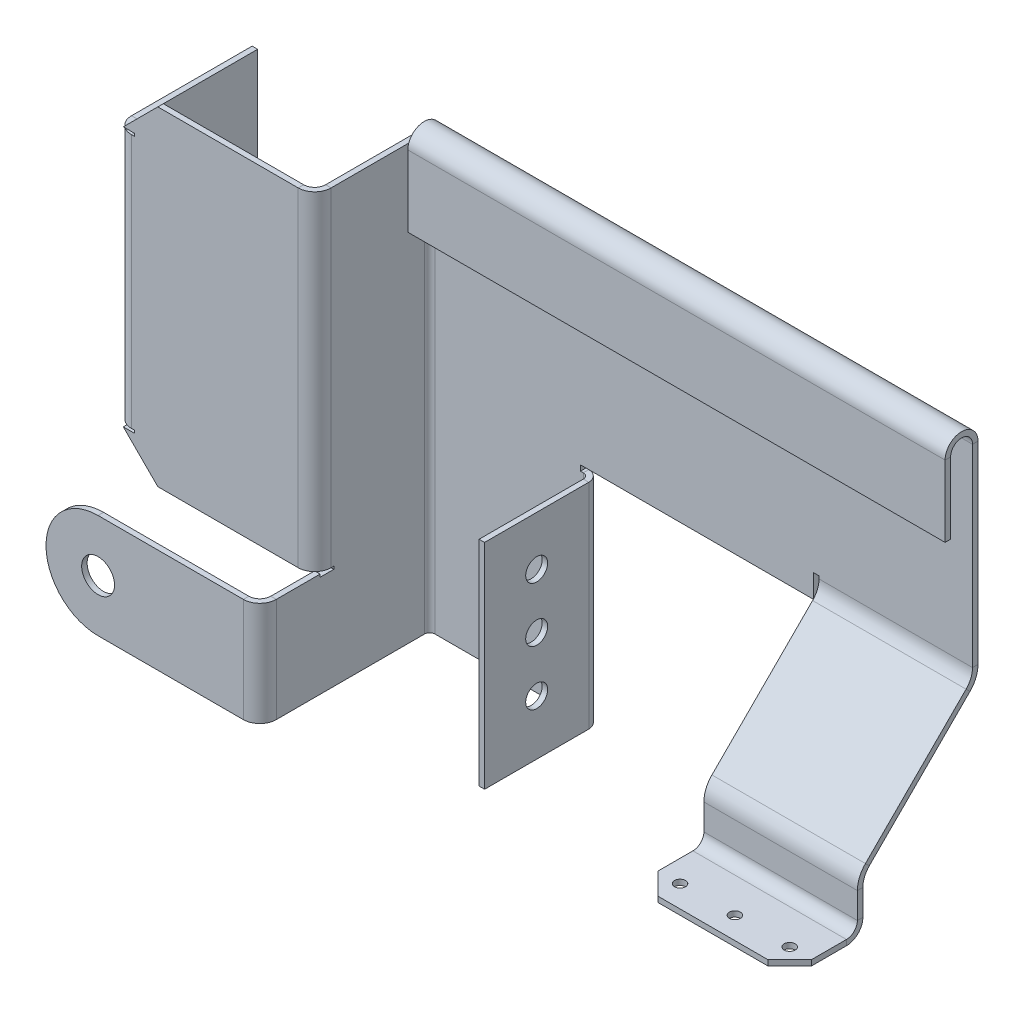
SolidWorks part; units mm, degrees
ref_plane "Plane1" through (0, 0, 0) normal (0, 0, 1) x (1, 0, 0)
ref_plane "Plane2" through (0, 0, 0) normal (0, 1, 0) x (1, 0, 0)
ref_plane "Plane3" through (0, 0, 0) normal (1, 0, 0) x (0, 0, -1)
imported_body "Imported1"
sheet metal parameters "Sheet-Metal1" parameters "D1"=5
bend "RoundBend1" bend radius 2.5 bend angle 90 parameters "D5"=1
flatten bends "Flatten-Bends1" parameters "D1"=0
sketch "Sharp-Sketch1" plane through (0, 0, 2.5) normal (0, 0, 1) x (1, 0, 0)
  line L0 (-49.5548, -100) -> (-49.5548, -2.5) construction
  line L1 (-122.9452, 97.5) -> (-122.9452, -100) construction
  line L2 (55, 4.9019) -> (125, 4.9019) construction
  line L3 (-198.2992, -100) -> (-198.2992, -52.5) construction
  line L4 (125, -68.8602) -> (55, -68.8602) construction
bend "RoundBend2" bend radius 2.5 bend angle 90 parameters "D5"=2
bend "RoundBend3" bend radius 10 bend angle 45 parameters "D5"=3
bend "RoundBend4" bend radius 5 bend angle 90 parameters "D5"=4
bend "RoundBend5" bend radius 10 bend angle 45 parameters "D5"=5
process bends "Process-Bends1" parameters "D1"=0
sketch "Flat-Sketch1" plane through (0, 0, 2.5) normal (0, 0, 1) x (1, 0, 0)
  line L0 (150, -90) -> (20, -90)
bend "FlatBend1" bend radius 5 bend angle 90 parameters "D5"=6
hem "Hem1" parameters "D1"=5, "D7"=40, "D8"=10, "D9"=0.1
bend "HemBend1" bend radius 5 bend angle 180 parameters "D5"=6
edge flange "Edge-Flange1" sketch "Sketch7" bend radius 5 parameters "D6"=10
sketch "Sketch7" plane through (-125, 0, 52.5) normal (0, 0, 1) x (0, 1, 0)
  line L0 (97.5, 0) -> (-52.5, 0) construction
  line L1 (97.5, 0) -> (-52.5, 0)
  line L2 (-52.5, 0) -> (-52.5, 86)
  line L3 (-52.5, 86) -> (97.5, 86)
  line L4 (97.5, 86) -> (97.5, 0)
bend "EdgeBend1" bend radius 5 bend angle 90 parameters "D5"=7
break corner "Break-Corner1" parameters "D1"=2000
edge flange "Edge-Flange2" sketch "Sketch14" bend radius 5 parameters "D6"=10
sketch "Sketch14" plane through (-211, 0, 52.5) normal (1, 0, 0) x (0, -1, 0)
  line L2 (-80.5, 0) -> (-80.5, 60)
  line L3 (-80.5, 60) -> (35.5, 60)
  line L4 (35.5, 60) -> (35.5, 0)
  line L6 (35.5, 0) -> (-80.5, 0) construction
  line L7 (35.5, 0) -> (-80.5, 0)
bend "EdgeBend2" bend radius 5 bend angle 90 parameters "D5"=8
flat pattern "Flat-Pattern1"
sketch "Bend-Lines1" plane through (0, 0, 2.5) normal (0, 0, 1) x (1, 0, 0)
  line L0 (-173.2992, -52.5) -> (-173.2992, 97.5) construction
  line L1 (-120, 107.3175) -> (125, 107.3175) construction
  line L2 (55, -90) -> (125, -90) construction
  line L3 (55, -68.8602) -> (125, -68.8602) construction
  line L4 (-198.2992, -52.5) -> (-198.2992, -100) construction
  line L5 (125, 4.9019) -> (55, 4.9019) construction
  line L6 (-122.9452, -100) -> (-122.9452, 97.5) construction
  line L7 (-49.5548, -2.5) -> (-49.5548, -100) construction
  line L8 (-259.1167, -35.5) -> (-259.1167, 80.5) construction
  line L9 (-259.1167, -35.5) -> (-259.1167, 80.5) construction
  line L10 (-173.2992, -52.5) -> (-173.2992, 97.5) construction
  line L11 (-120, 107.3175) -> (125, 107.3175) construction
  line L12 (55, -90) -> (125, -90) construction
  line L13 (55, -68.8602) -> (125, -68.8602) construction
  line L14 (-198.2992, -52.5) -> (-198.2992, -100) construction
  line L15 (125, 4.9019) -> (55, 4.9019) construction
  line L16 (-122.9452, -100) -> (-122.9452, 97.5) construction
  line L17 (-49.5548, -2.5) -> (-49.5548, -100) construction
bend of the flat pattern "Flatten-<RoundBend1>1"
bend of the flat pattern "Flatten-<RoundBend2>1"
bend of the flat pattern "Flatten-<RoundBend3>1"
bend of the flat pattern "Flatten-<RoundBend4>1"
bend of the flat pattern "Flatten-<RoundBend5>1"
bend of the flat pattern "Flatten-<HemBend1>1"
bend of the flat pattern "Flatten-<EdgeBend1>1"
bend of the flat pattern "Flatten-<FlatBend1>1"
bend of the flat pattern "Flatten-<EdgeBend2>1"
